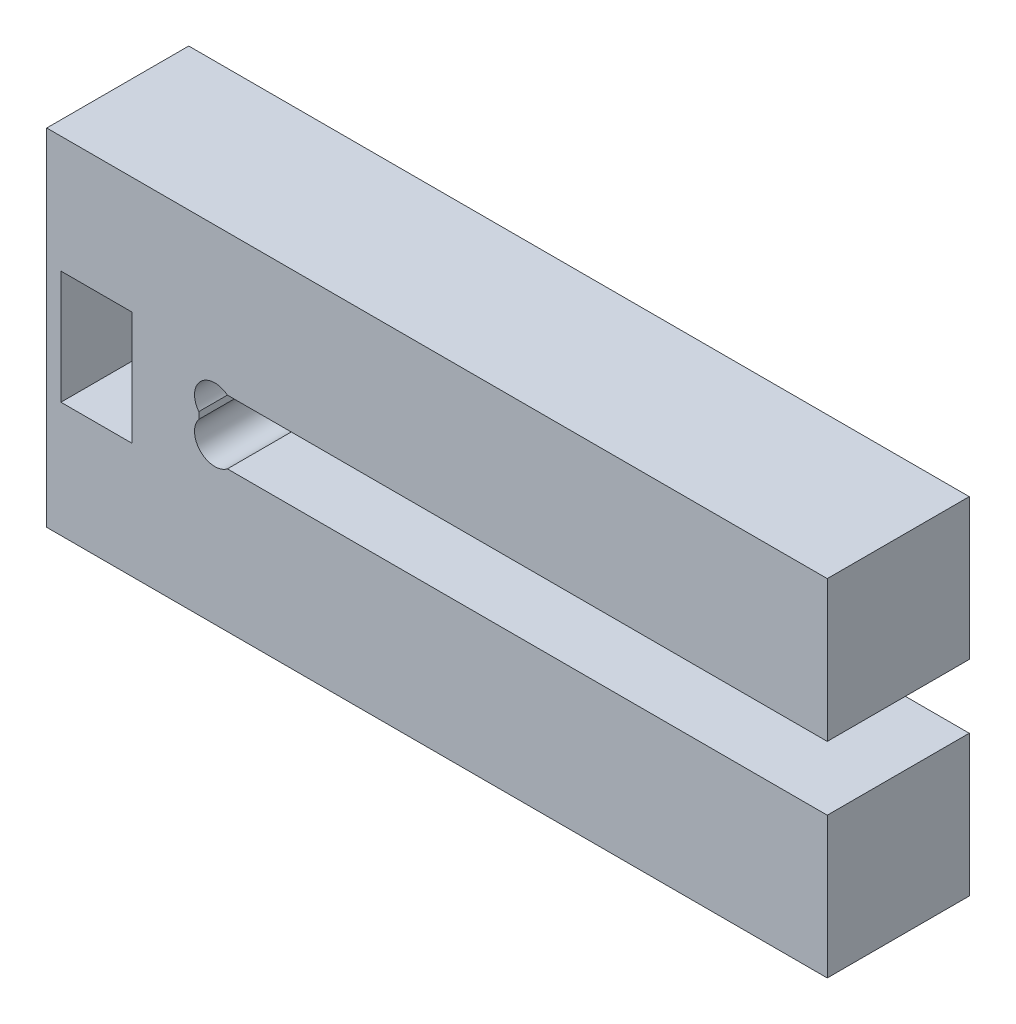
SolidWorks part; units mm, degrees
ref_plane "Plan de face" through (0, 0, 0) normal (0, 0, 1) x (1, 0, 0)
ref_plane "Plan de dessus" through (0, 0, 0) normal (0, 1, 0) x (1, 0, 0)
ref_plane "Plan de droite" through (0, 0, 0) normal (1, 0, 0) x (0, 0, -1)
sketch "Esquisse1" plane through (0, 0, 0) normal (0, 0, 1) x (1, 0, 0)
  line L0 (27.485, -2.25) -> (27.485, -12.18)
  line L1 (-27.485, 12.18) -> (27.485, 12.18)
  line L2 (-27.485, 12.18) -> (-27.485, -12.18)
  line L3 (-27.485, -12.18) -> (27.485, -12.18)
  line L4 (27.485, 12.18) -> (27.485, 2.25)
  line L5 (-27.485, 12.18) -> (27.485, -12.18) construction
  line L6 (-27.485, -12.18) -> (27.485, 12.18) construction
  line L7 (27.485, 2.25) -> (-14.7623, 2.25)
  line L8 (-16.775, 0) -> (-19.1785, 0) construction
  line L9 (27.485, -2.25) -> (-14.7623, -2.25)
  line L10 (-16.775, 0.2373) -> (-16.775, -0.2373)
  line L11 (-19.1785, 0) -> (-12.496, 0) construction
  line L12 (-14.7623, 2.25) -> (-23.2812, 2.25) construction
  line L13 (-16.775, 0.1673) -> (-16.775, 6.3182) construction
  line L14 (-16.775, 2.25) -> (-15.2822, 0.7572) construction
  arc A0 (-14.7623, 2.25) -> (-16.775, 0.2373) centre (-15.6436, 1.1186) ccw
  arc A1 (-14.7623, -2.25) -> (-16.775, -0.2373) centre (-15.6436, -1.1186) cw
  point P0 (0, 0)
  point P15 (-15.6436, 1.1186)
  dimension "D1" = 54.97
  dimension "D2" = 24.36
  dimension "D3" = 10.71
  dimension "D4" = 9.93
  dimension "D5" = 9.93
  dimension "D6" = 45
  dimension "D7" = 1.6
extrude "Boss.-Extru.1" add sketch "Esquisse1" along normal blind 10
sketch "Esquisse3" plane through (0, 0, 10) normal (0, 0, 1) x (1, 0, 0)
  line L1 (-26.485, 3.9527) -> (-21.485, 3.9527)
  line L2 (-26.485, 3.9527) -> (-26.485, -4.0473)
  line L3 (-26.485, -4.0473) -> (-21.485, -4.0473)
  line L4 (-21.485, 3.9527) -> (-21.485, -4.0473)
  line L5 (27.485, 12.18) -> (-27.485, 12.18) construction
  line L6 (-27.485, 12.18) -> (-27.485, -12.18) construction
  point P8 (-27.485, 0)
  dimension "D1" = 5
  dimension "D2" = 8
  dimension "D4" = 8.2273
  dimension "D5" = 1
extrude "Enlèv. mat.-Extru.2" cut sketch "Esquisse3" against normal blind 9
